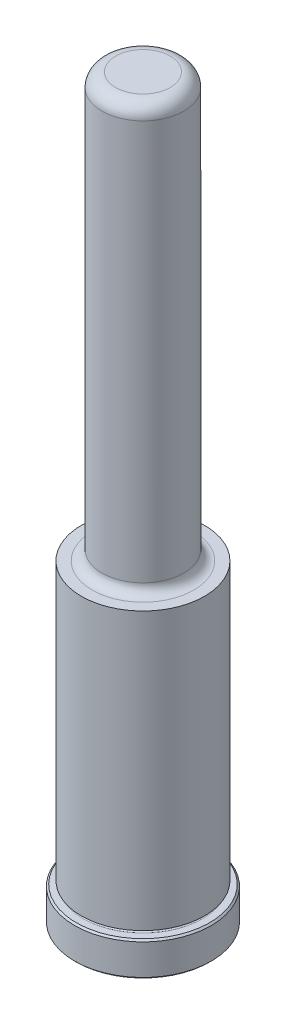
SolidWorks part; units mm, degrees
ref_plane "Front Plane" through (0, 0, 0) normal (0, 0, 1) x (1, 0, 0)
ref_plane "Top Plane" through (0, 0, 0) normal (0, 1, 0) x (1, 0, 0)
ref_plane "Right Plane" through (0, 0, 0) normal (1, 0, 0) x (0, 0, -1)
sketch "Sketch1" plane through (0, 0, 0) normal (1, 0, 0) x (0, 0, -1)
  line L0 (0, 0) -> (15.875, 0)
  line L1 (15.875, 0) -> (15.875, 7.9248)
  line L2 (15.875, 7.9248) -> (13.8938, 7.9248)
  line L3 (13.5128, 2.6782) -> (13.5128, 5.9795) construction
  line L4 (13.8938, 8.6868) -> (14.3002, 8.6868)
  line L5 (14.3002, 8.6868) -> (14.3002, 73.025)
  line L6 (14.3002, 73.025) -> (11.7983, 73.025)
  line L7 (9.5123, 75.311) -> (9.5123, 171.45)
  line L9 (9.5123, 171.45) -> (0, 171.45)
  line L10 (0, 171.45) -> (0, 0)
  line L11 (0, 0) -> (0, -7.2694) construction
  arc A0 (13.8938, 8.6868) -> (13.8938, 7.9248) centre (13.8938, 8.3058) ccw
  arc A1 (11.7983, 73.025) -> (9.5123, 75.311) centre (11.7983, 75.311) cw
  point P2 (9.5123, 171.45)
  point P14 (9.5123, 171.3104)
  point P19 (9.5123, 73.025)
  dimension "D14" = 0.762
  dimension "D8" = 2.286
  dimension "T" = 7.9248
  dimension "D2" = 0.762
  dimension "M" = 31.75
  dimension "B" = 28.6004
  dimension "L" = 171.45
  dimension "D7" = 0.7874
  dimension "A" = 73.025
  dimension "D" = 19.0246
  dimension "D15" = 98.425
revolve "Revolve1" add sketch "Sketch1" angle 360 about L11
chamfer "Chamfer1" distance 0.381 angle 45 2 edges at (0, 0, 15.875) (0, 7.9248, 15.875)
fillet "Fillet7" radius 3.175 1 edges at (0, 171.45, 9.5123)
